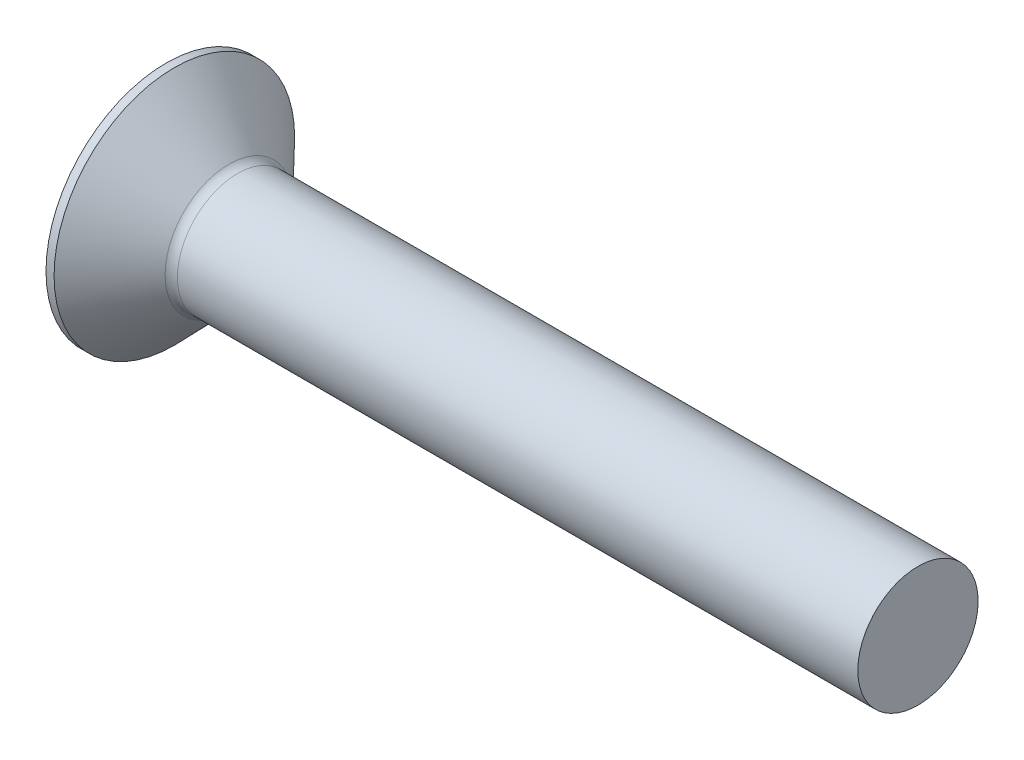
SolidWorks part; units mm, degrees
ref_plane "Front Plane" through (0, 0, 0) normal (0, 0, 1) x (1, 0, 0)
ref_plane "Top Plane" through (0, 0, 0) normal (0, 1, 0) x (1, 0, 0)
ref_plane "Right Plane" through (0, 0, 0) normal (1, 0, 0) x (0, 0, -1)
sketch "BodySke" plane through (0, 0, 0) normal (0, 0, 1) x (1, 0, 0)
  line L0 (1.8, 0) -> (111.3824, 0) construction
  line L1 (1.8, 0) -> (1.8, 8) construction
  line L2 (1.8, 8) -> (2.3372, 8)
  line L3 (2.3372, 8) -> (6.2, 4)
  line L4 (6.2, 4) -> (51.8, 4)
  line L5 (51.8, 4) -> (51.8, 0)
  line L6 (7.45, 1.8551) -> (7.45, -12.8628) construction
  line L7 (1.8, 0) -> (51.8, 0)
  line L8 (21.8, 2.8551) -> (21.8, -10.9269) construction
  line L9 (1.8, -8) -> (2.3372, -8) construction
  line L10 (2.3372, -8) -> (6.2, -4) construction
  line L11 (6.2, -4) -> (51.8, -4) construction
  line L12 (1.8, 0) -> (-7.747, 0) construction
  line L13 (0, 0) -> (0, 16.1338) construction
  line L14 (1.8, 0) -> (0, 0)
  arc A0 (0, 0) -> (1.8, 8) centre (18.6778, 0) cw
  point P10 (51.8, 3.4455)
  dimension "Diameter" = 8
  dimension "Head_dia" = 16
  dimension "Head_height" = 4.4
  dimension "Length" = 50
  dimension "Advance" = 1.25
  dimension "Thread_minor" = 6.891
  dimension "Thread_length" = 30
  dimension "Head_ang" = 92
  dimension "Oval_height" = 1.8
revolve "BaseBody" add sketch "BodySke" angle 360 about L0
fillet "Fillet1" radius 0.8 1 edges at (6.2, 0, 4)
ref_plane "Plane1" through (5.18, 0, 0) normal (1, 0, 0) x (0, 0, -1)
sketch "RecSkeTop" plane through (0, 0, 0) normal (1, 0, 0) x (0, 0, -1)
  line L1 (-0.946, 4.3) -> (0.946, 4.3)
  line L2 (-0.946, 4.3) -> (-0.946, -4.3)
  line L3 (-0.946, -4.3) -> (0.946, -4.3)
  line L4 (0.946, 4.3) -> (0.946, -4.3)
  dimension "D1" = 4.3
  dimension "Cross_dia" = 8.6
  dimension "D2" = 1.892
  dimension "D3" = 0.946
sketch "RecSkeBot" plane through (5.18, 0, 0) normal (1, 0, 0) x (0, 0, -1)
  line L0 (-0.946, 4.3) -> (-0.946, -4.3) construction
  line L1 (-0.946, 1.7173) -> (0.946, 1.7173)
  line L2 (-0.946, 1.7173) -> (-0.946, -1.7173)
  line L3 (-0.946, -1.7173) -> (0.946, -1.7173)
  line L4 (0.946, 1.7173) -> (0.946, -1.7173)
  line L5 (0.946, 4.3) -> (0.946, -4.3) construction
  dimension "D1" = 3.4347
  dimension "D2" = 1.7173
loft "Recess" cut profiles "RecSkeTop", "RecSkeBot"
pattern_circular "RecPat" count 2 every 90 about axis through (0, 0, 0) along (1, 0, 0) of "Recess"
sketch "RecCorSke" plane through (0, 0, 0) normal (0, 0, 1) x (1, 0, 0)
  line L0 (0, 0) -> (57.5987, 0) construction
  line L1 (0, 0) -> (0, 2.0812)
  line L3 (0, 2.0812) -> (5.18, 1.719)
  line L4 (5.18, 1.719) -> (5.7385, 0)
  line L5 (5.7385, 0) -> (0, 0)
  dimension "D1" = 18
  dimension "D2" = 5.18
  dimension "D3" = 2.0812
  dimension "D4" = 4
revolve "RecessCore" cut sketch "RecCorSke" angle 360 about L0
sketch "ThdSchSke" plane through (0, 0, 0) normal (0, 0, 1) x (1, 0, 0)
  line L0 (0, 0) -> (55.1256, 0) construction
  line L1 (1.8, 0) -> (111.3824, 0) construction
  line L2 (51.4799, 4) -> (51.4799, 4.6403)
  line L3 (51.4799, 4.6403) -> (52.1201, 4.6403)
  line L4 (52.1201, 4.6403) -> (52.1201, 4)
  line L5 (52.1201, 4) -> (51.8, 3.4455)
  line L6 (51.8, 3.4455) -> (51.4799, 4)
  line L7 (6.2, 4) -> (51.8, 4) construction
  line L13 (51.8, 4) -> (51.8, 0) construction
revolve "ThreadSchematic" [suppressed] cut sketch "ThdSchSke" angle 360 about L0
pattern_linear "ThdSchPat" [suppressed] count 24 along (1, 0, 0)
equation "\"Thread_minor@ThreadCosmetic\" = \"Thread_minor@BodySke\""
equation "\"D1@RecSkeTop\" = \"Cross_dia@RecSkeTop\" / 2"
equation "\"D2@RecSkeTop\" = \"Cross_dia@RecSkeTop\" * 0.22"
equation "\"D3@RecSkeTop\" = \"D2@RecSkeTop\" / 2"
equation "\"D1@RecSkeBot\" = \"Cross_dia@RecSkeTop\" - 2 * \"Cross_depth@Plane1\" *  tan( 26.5 * 0.017453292 ) "
equation "\"D2@RecSkeBot\" = \"D1@RecSkeBot\" / 2"
equation "\"D2@RecCorSke\" = \"Cross_depth@Plane1\""
equation "\"D3@RecCorSke\" = \"D2@RecSkeTop\" * 1.1"
equation "\"Advance@ThdSchPat\" = \"Advance@BodySke\""
equation "\"D1@ThdSchPat\" =  int( \"Thread_length@BodySke\" / \"Advance@ThdSchPat\" ) "
